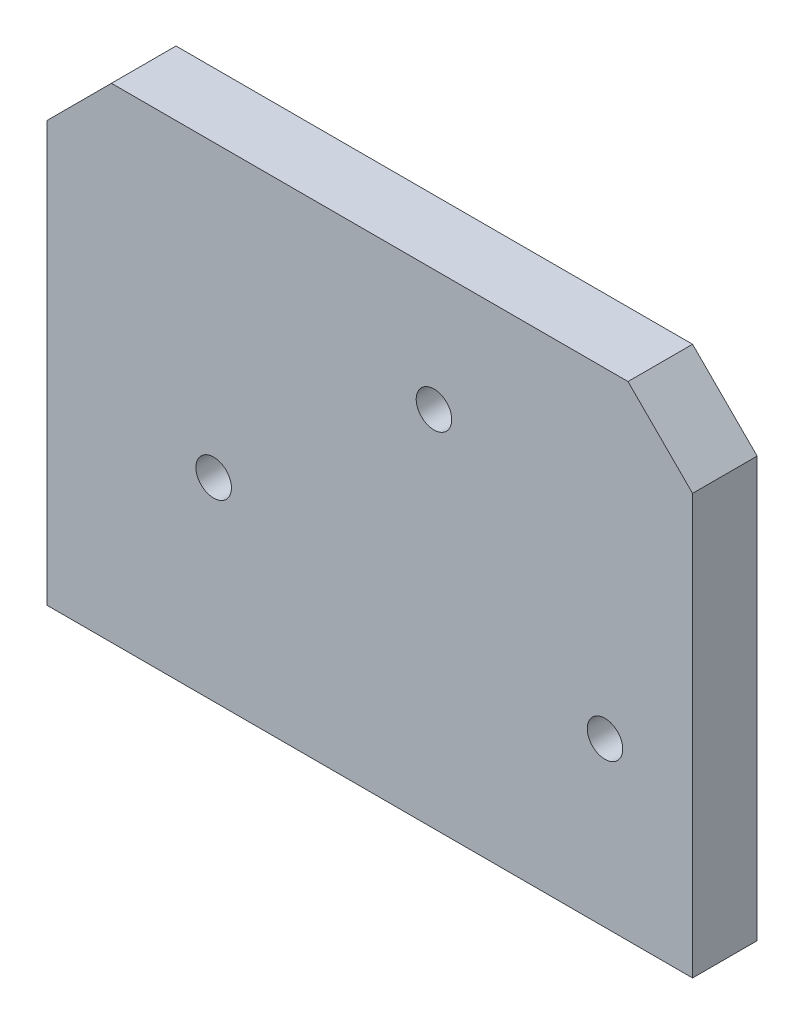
SolidWorks part; units mm, degrees
ref_plane "Ebene vorne" through (0, 0, 0) normal (0, 0, 1) x (1, 0, 0)
ref_plane "Ebene oben" through (0, 0, 0) normal (0, 1, 0) x (1, 0, 0)
ref_plane "Ebene rechts" through (0, 0, 0) normal (1, 0, 0) x (0, 0, -1)
sketch "Skizze1" plane through (0, 0, 0) normal (0, 0, 1) x (1, 0, 0)
  line L0 (100, 75) -> (-100, -75) construction
  line L1 (-100, 75) -> (100, 75)
  line L2 (-100, 75) -> (-100, -75)
  line L3 (-100, -75) -> (100, -75)
  line L4 (100, 75) -> (100, -75)
  dimension "D1" = 150
  dimension "D2" = 200
extrude "Linear austragen1" add sketch "Skizze1" along normal blind 20
chamfer "Fase1" distance 20 angle 45 2 edges at (-100, 75, 10) (100, 75, 10)
hole_wizard "Durchgangsloch für M101" positions "Skizze2" profile "Skizze3" hole size "M10" standard "DIN"
sketch "Skizze2" plane through (0, 0, 40) normal (0, 0, 1) x (1, 0, 0)
  point P0 (-48.3308, -14.941)
  point P2 (19.903, 37.4631)
  point P4 (72.8706, -24.4007)
sketch "Skizze3" plane through (-48.3308, -14.941, 40) normal (1, 0, 0) x (0, -1, 0)
  line L0 (0, 0) -> (0, 40)
  line L1 (0, 40) -> (5.5, 40)
  line L2 (5.5, 40) -> (5.5, 0)
  line L3 (5.5, 0) -> (0, 0)
  line L4 (0, -6.35) -> (0, 107.95) construction
  dimension "Bohrerdurchmesser" = 11
  dimension "Bohrungstiefe" = 40
